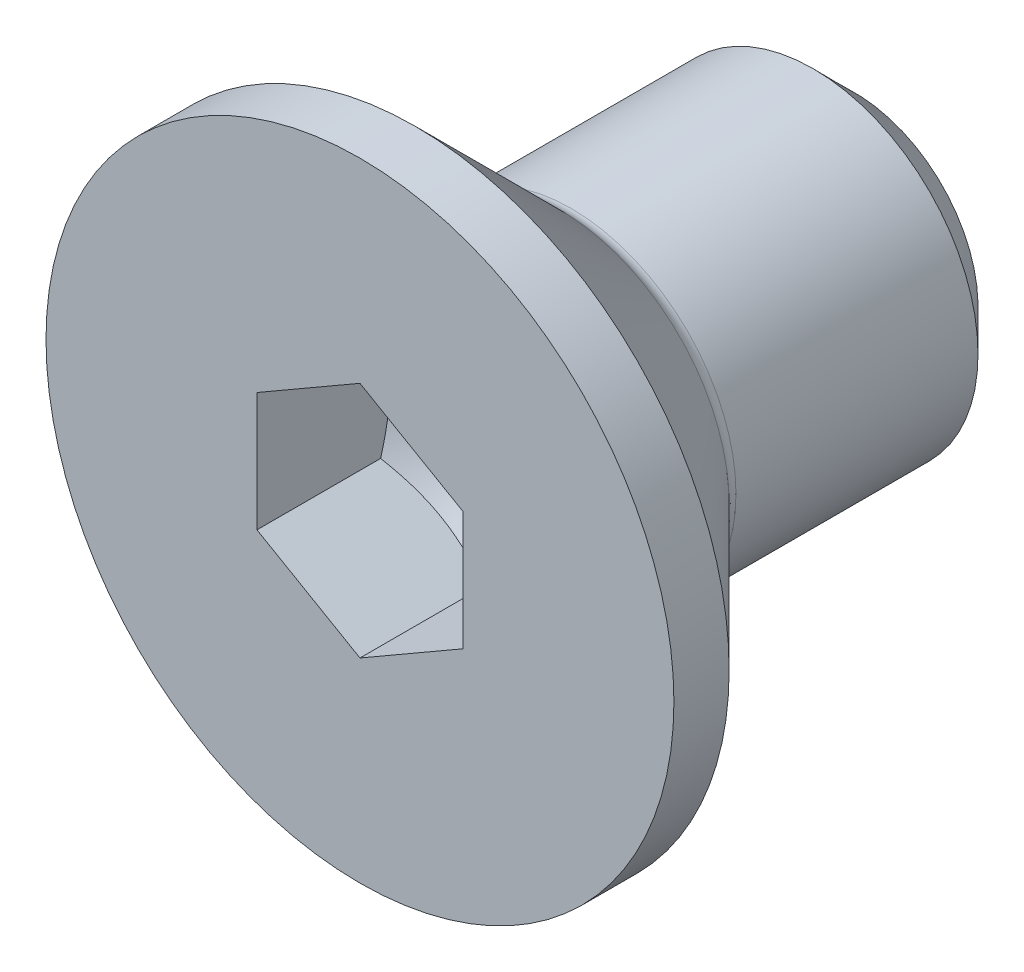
SolidWorks part; units mm, degrees
ref_plane "Спереди" through (0, 0, 0) normal (0, 0, 1) x (1, 0, 0)
ref_plane "Сверху" through (0, 0, 0) normal (0, 1, 0) x (1, 0, 0)
ref_plane "Справа" through (0, 0, 0) normal (1, 0, 0) x (0, 0, -1)
sketch "Sketch1" plane through (0, 0, 0) normal (1, 0, 0) x (0, 0, -1)
  line L0 (0, 0) -> (12, 0) construction
  line L1 (0, 0) -> (0, 7.62)
  line L2 (0, 7.62) -> (1.34, 7.62)
  line L3 (1.34, 7.62) -> (4.96, 4)
  line L4 (4.96, 4) -> (12, 4)
  line L6 (12, 4) -> (12, 0)
  line L7 (1.34, -7.62) -> (4.96, -4) construction
  line L10 (0, 0) -> (12, 0)
  line L11 (12, 0) -> (16.6953, 0) construction
revolve "RevolveBase" add sketch "Sketch1" angle 360 about L11
sketch "Sketch2" plane through (0, 0, 0) normal (0, 0, 1) x (1, 0, 0)
  line L1 (0, 2.8868) -> (-2.5, 1.4434)
  line L2 (-2.5, 1.4434) -> (-2.5, -1.4434)
  line L3 (-2.5, -1.4434) -> (0, -2.8868)
  line L4 (0, -2.8868) -> (2.5, -1.4434)
  line L5 (2.5, -1.4434) -> (2.5, 1.4434)
  line L6 (2.5, 1.4434) -> (0, 2.8868)
  circle A0 centre (0, 0) radius 2.5 construction
  circle A1 centre (0, 0) radius 2.8615 construction
extrude "HexHead" cut sketch "Sketch2" against normal blind 3
sketch "Sketch3" plane through (0, 0, -3) normal (0, 0, 1) x (1, 0, 0)
  line L1 (0, 2.8868) -> (-2.5, 1.4434)
  line L2 (-2.5, 1.4434) -> (-2.5, -1.4434)
  line L3 (-2.5, -1.4434) -> (0, -2.8868)
  line L4 (0, -2.8868) -> (2.5, -1.4434)
  line L5 (2.5, -1.4434) -> (2.5, 1.4434)
  line L6 (2.5, 1.4434) -> (0, 2.8868)
  circle A0 centre (0, 0) radius 2.5 construction
extrude "HexHead2" cut sketch "Sketch3" against normal blind 1.8316
sketch "Sketch4" plane through (0, 0, 0) normal (1, 0, 0) x (0, 0, -1)
  line L0 (0, 0) -> (12, 0) construction
  line L2 (4.8316, 0) -> (4.6681, 0)
  line L3 (4.6681, 0) -> (3, 2.8892)
  line L4 (4.8316, 0) -> (4.8316, 2.8892)
  line L5 (4.8316, 2.8892) -> (3, 2.8892)
  line L6 (0, 7.62) -> (0, -7.62) construction
  line L7 (12, -4) -> (12, 4) construction
revolve "RevolveHead" add sketch "Sketch4" angle 360 about L0
chamfer "Chamfer" distance 1 1 edges at (0, -4, -12)
sketch "Sketch5" plane through (0, 0, 0) normal (1, 0, 0) x (0, 0, -1)
  line L0 (0, 0) -> (4.96, 0) construction
  line L1 (4.96, 0) -> (4.96, 4) construction
  line L2 (4.96, 4) -> (2.96, 6)
surface "Surface" sketch "Sketch5" parameters "D1"=360
fillet "Fillet1" radius 0.4 1 edges at (0, -4, -4.96)
equation "\"D1@HexHead2\" = \"e@Sketch2\" * tan ( 60 ) "
equation "\"D1@Sketch3\"=\"S@Sketch2\""
equation "\"D1@Sketch4\"=\"t@HexHead\"+\"D1@HexHead2\""
equation "\"D2@Sketch4\"= \"t@HexHead\""
equation "\"D3@Sketch4\"=\"S@Sketch2\" * 1.1557"
equation "\"D1@Sketch5\"= \"k@Sketch1\""
equation "\"D2@Sketch5\"= \"d@Sketch1\""
equation "\"D3@Sketch5\"= 1.5 * \"d@Sketch1\""
